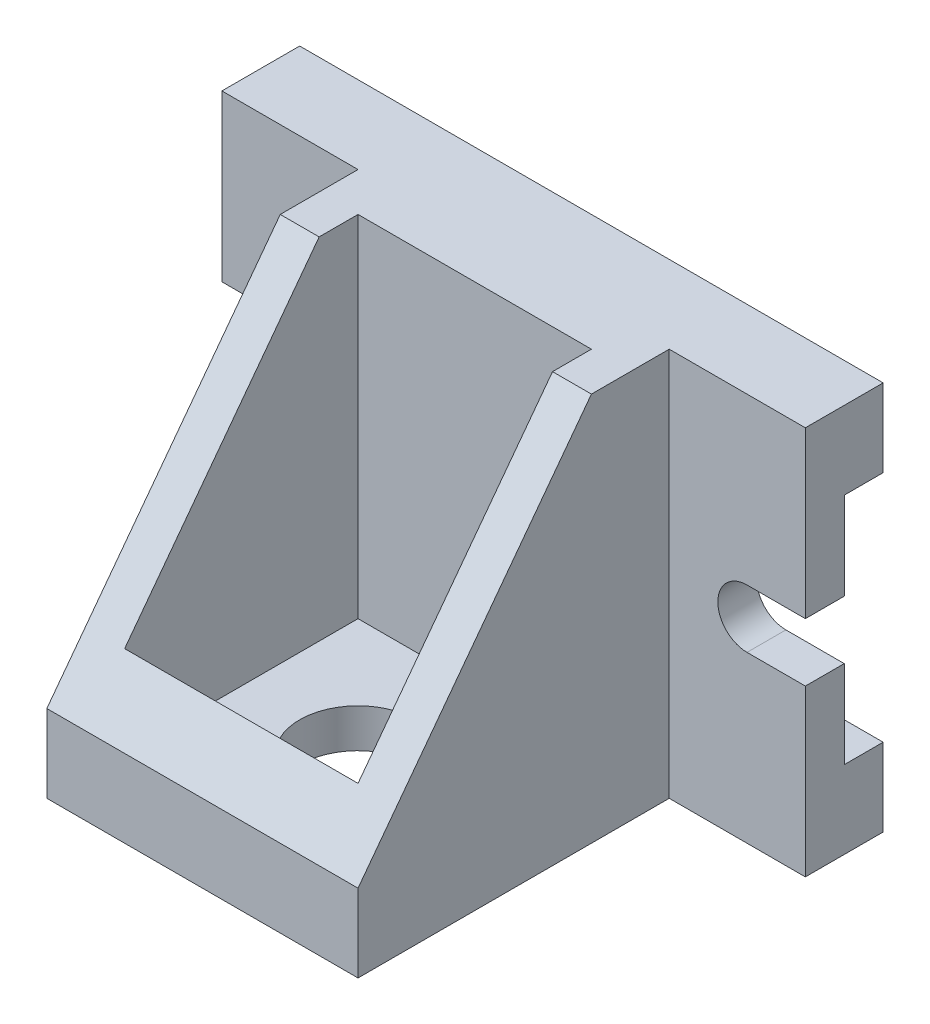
SolidWorks part; units mm, degrees
ref_plane "Alzado" through (0, 0, 0) normal (0, 0, 1) x (1, 0, 0)
ref_plane "Planta" through (0, 0, 0) normal (0, 1, 0) x (1, 0, 0)
ref_plane "Vista lateral" through (0, 0, 0) normal (1, 0, 0) x (0, 0, -1)
sketch "Croquis2" plane through (0, 0, 0) normal (0, 0, 1) x (1, 0, 0)
  line L0 (0, 74.65) -> (0, -91.4572) construction
  line L1 (-75, 50) -> (75, 50)
  line L2 (-75, 50) -> (-75, 7.5)
  line L3 (-75, -50) -> (75, -50)
  line L4 (75, 50) -> (75, 7.5)
  line L5 (-75, 50) -> (75, -50) construction
  line L6 (-75, -50) -> (75, 50) construction
  line L7 (-60, 7.5) -> (-75, 7.5)
  line L8 (-60, -7.5) -> (-75, -7.5)
  line L9 (60, -7.5) -> (75, -7.5)
  line L10 (60, 7.5) -> (75, 7.5)
  line L11 (-75, -7.5) -> (-75, -50)
  line L12 (75, -7.5) -> (75, -50)
  arc A0 (-60, -7.5) -> (-60, 7.5) centre (-60, 0) ccw
  arc A1 (60, -7.5) -> (60, 7.5) centre (60, 0) cw
  point P0 (0, 0)
  dimension "D3" = 15
  dimension "D1" = 150
  dimension "D2" = 100
  dimension "D4" = 15
  dimension "D5" = 50
extrude "Saliente-Extruir1" add sketch "Croquis2" along normal blind 20
sketch "Croquis3" plane through (-75, 0, 0) normal (-1, 0, 0) x (0, 0, 1)
  line L1 (0, 30) -> (10, 30)
  line L2 (0, 30) -> (0, -30)
  line L3 (0, -30) -> (10, -30)
  line L4 (10, 30) -> (10, -30)
  line L9 (0, 50) -> (0, 7.5) construction
  dimension "D1" = 10
  dimension "D2" = 60
  dimension "D3" = 0
extrude "Cortar-Extruir1" cut sketch "Croquis3" against normal through all both and the other way through all
sketch "Croquis5" plane through (75, 0, 0) normal (1, 0, 0) x (0, 0, -1)
  line L1 (-40, 50) -> (-20, 50)
  line L3 (-40, -50) -> (-20, -50)
  line L4 (-20, 50) -> (-20, -50)
  line L8 (-40, -50) -> (-100, -50)
  line L9 (-100, -50) -> (-100, -30)
  line L10 (-100, -30) -> (-40, 50)
  line L11 (0, -50) -> (0, -30) construction
  point P0 (-30, 0)
  dimension "D2" = 100
  dimension "D3" = 20
  dimension "D4" = 100
extrude "Saliente-Extruir2" add sketch "Croquis5" against normal through all
sketch "Croquis6" plane through (75, 0, 0) normal (1, 0, 0) x (0, 0, -1)
  line L1 (-20, 50) -> (-100, 50)
  line L2 (-20, 50) -> (-20, -50)
  line L3 (-20, -50) -> (-100, -50)
  line L4 (-100, 50) -> (-100, -50)
  line L5 (-100, -50) -> (0, -50) construction
  line L6 (-40, 50) -> (0, 50) construction
  line L7 (-100, -30) -> (-100, -50) construction
  point P8 (0, 0)
  dimension "D1" = 0
  dimension "D2" = 80
  dimension "D3" = 0
extrude "Cortar-Extruir2" cut sketch "Croquis6" against normal blind 35 and the other way through all
sketch "Croquis7" plane through (-75, 0, 0) normal (-1, 0, 0) x (0, 0, 1)
  line L0 (40, 50) -> (0, 50) construction
  line L1 (20, 50) -> (100, 50)
  line L2 (20, 50) -> (20, -50)
  line L3 (20, -50) -> (100, -50)
  line L4 (100, 50) -> (100, -50)
  line L5 (100, -50) -> (0, -50) construction
  line L6 (20, -7.5) -> (20, 7.5) construction
  line L7 (100, -30) -> (100, -50) construction
  dimension "D1" = 0
  dimension "D2" = 0
extrude "Cortar-Extruir3" cut sketch "Croquis7" against normal blind 35
sketch "Croquis8" plane through (0, 50, 0) normal (0, 1, 0) x (1, 0, 0)
  line L0 (75, 0) -> (-75, 0) construction
  line L1 (-30, -30) -> (30, -30)
  line L2 (-30, -30) -> (-30, -90)
  line L3 (-30, -90) -> (30, -90)
  line L4 (30, -30) -> (30, -90)
  line L5 (40, -40) -> (40, -100) construction
  dimension "D1" = 30
  dimension "D2" = 60
  dimension "D3" = 60
  dimension "D4" = 10
extrude "Cortar-Extruir4" cut sketch "Croquis8" against normal blind 90
sketch "Croquis9" plane through (0, 50, 0) normal (0, 1, 0) x (1, 0, 0)
  line L0 (75, 0) -> (-75, 0) construction
  line L2 (-40, -40) -> (-40, -100) construction
  circle A0 centre (0, -60) radius 15
  point P6 (-24.2914, -90)
  dimension "D1" = 30
  dimension "D2" = 60
  dimension "D3" = 40
extrude "Cortar-Extruir5" cut sketch "Croquis9" against normal through all
